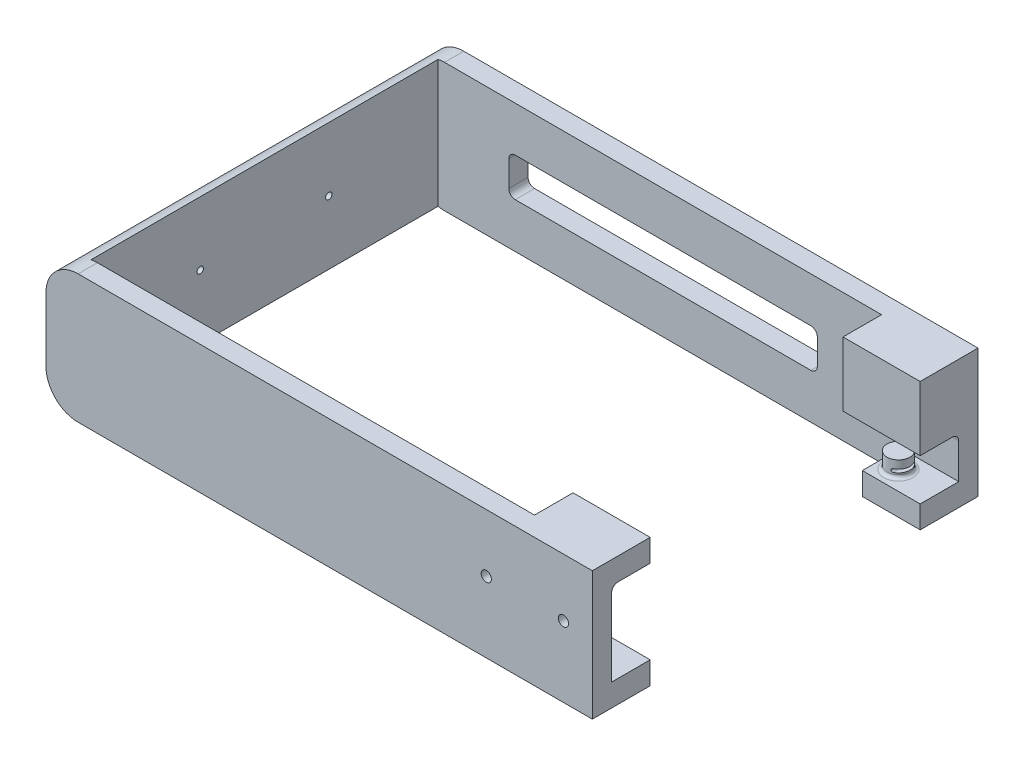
SolidWorks part; units mm, degrees
ref_plane "Front Plane" through (0, 0, 0) normal (0, 0, 1) x (1, 0, 0)
ref_plane "Top Plane" through (0, 0, 0) normal (0, 1, 0) x (1, 0, 0)
ref_plane "Right Plane" through (0, 0, 0) normal (1, 0, 0) x (0, 0, -1)
sketch "Sketch1" plane through (0, 0, 0) normal (0, 0, 1) x (1, 0, 0)
  line L1 (-42.5, 20) -> (42.5, 20)
  line L2 (-42.5, 20) -> (-42.5, 0)
  line L3 (-42.5, 0) -> (42.5, 0)
  line L4 (42.5, 20) -> (42.5, 0)
  dimension "D1" = 20
  dimension "D2" = 85
extrude "Extrude1" add sketch "Sketch1" along normal blind 3
sketch "Sketch2" plane through (0, 0, 0) normal (0, 1, 0) x (1, 0, 0)
  line L0 (33.5, -3) -> (33.5, -9)
  line L1 (42.5, -3) -> (-42.5, -3) construction
  line L2 (42.5, -3) -> (42.5, -9)
  line L3 (33.5, -3) -> (42.5, -3)
  line L4 (42.5, -9) -> (33.5, -9)
  line L5 (42.5, -3) -> (42.5, 0) construction
  dimension "D1" = 6
  dimension "D2" = 9
extrude "Extrude2" add sketch "Sketch2" along normal blind 3.5
sketch "Sketch4" plane through (0, 0, 3) normal (0, 0, 1) x (1, 0, 0)
  line L0 (-42.5, 0) -> (33.5, 0) construction
  line L1 (-42.5, 20) -> (-38.5, 20)
  line L2 (-42.5, 20) -> (-42.5, 0)
  line L3 (-42.5, 0) -> (-38.5, 0)
  line L4 (-38.5, 20) -> (-38.5, 0)
  dimension "D1" = 4
extrude "Extrude3" add sketch "Sketch4" along normal blind 27
mirror "Mirror2" about plane through (-42.5, 0, 30) normal (0, 0, 1) of "Extrude3", "Extrude1"
sketch "Sketch8" plane through (0, 0, 57) normal (0, 0, 1) x (1, 0, 0)
  line L1 (-42.5, 0) -> (42.5, 0)
  line L2 (-42.5, 0) -> (-42.5, 20)
  line L3 (-42.5, 20) -> (42.5, 20)
  line L4 (42.5, 0) -> (42.5, 20)
extrude "Extrude5" add sketch "Sketch8" along normal blind 3
ref_plane "Plane1" through (0, 0, 30) normal (0, 0, 1) x (1, 0, 0)
mirror "Mirror3" about plane through (0, 0, 30) normal (0, 0, 1) of "Extrude2"
fillet "Fillet1" radius 5 7 edges at (-42.5, 20, 30) (-42.5, 0, 30)
sketch "Sketch14" plane through (0, 0, 0) normal (0, 0, -1) x (-1, 0, 0)
  line L0 (-42.5, 10) -> (42.5, 10) construction
  line L1 (-20.5, 13) -> (27.5, 13)
  line L2 (-20.5, 13) -> (-20.5, 7)
  line L3 (-20.5, 7) -> (27.5, 7)
  line L4 (27.5, 13) -> (27.5, 7)
  line L5 (-42.5, 0) -> (-42.5, 20) construction
  line L6 (42.5, 15) -> (42.5, 5) construction
  line L8 (38.5, 0.101) -> (38.5, 19.899) construction
  dimension "D1" = 6
  dimension "D2" = 22
  dimension "D3" = 11
extrude "Cut-Extrude1" cut sketch "Sketch14" against normal up to next
sketch "Sketch16" plane through (0, 20, 0) normal (0, 1, 0) x (-1, 0, 0)
  line L1 (-42.5, 3) -> (-30.5, 3)
  line L2 (-42.5, 3) -> (-42.5, 9)
  line L3 (-42.5, 9) -> (-30.5, 9)
  line L4 (-30.5, 3) -> (-30.5, 9)
  dimension "D1" = 12
  dimension "D2" = 6
extrude "Stop1" add sketch "Sketch16" against normal blind 10
sketch "Sketch19" plane through (0, 20, 0) normal (0, 1, 0) x (-1, 0, 0)
  line L0 (-42.5, 57) -> (37.5, 57) construction
  line L1 (-30.5, 57) -> (-42.5, 57)
  line L2 (-42.5, 57) -> (-42.5, 51)
  line L3 (-42.5, 51) -> (-30.5, 51)
  line L4 (-30.5, 57) -> (-30.5, 51)
  dimension "D1" = 12
  dimension "D2" = 6
extrude "Stop2" add sketch "Sketch19" against normal blind 3.5
ref_plane "Plane2" through (0, 0, 6) normal (0, 0, 1) x (1, 0, 0)
ref_plane "Plane3" through (0, 0, 54) normal (0, 0, 1) x (1, 0, 0)
ref_plane "Plane4" through (0, 10, 0) normal (0, 1, 0) x (-1, 0, 0)
hole_wizard "1/16 (0.0625) Diameter Hole1" positions "Sketch26" profile "Sketch25" hole size "1/16" standard "Ansi Inch"
sketch "Sketch26" plane through (0, 0, 57) normal (0, 0, -1) x (-1, 0, 0)
  line L1 (-42.5, 0) -> (-42.5, 20) construction
  line L3 (-38, 11) -> (-26, 11) construction
  line L4 (-42.5, 10) -> (-20.5, 10) construction
  line L5 (-20.5, 13) -> (-20.5, 7) construction
  point P0 (-26, 11)
  point P1 (-38, 11)
  dimension "D1" = 12
  dimension "D2" = 4.5
  dimension "D3" = 1
sketch "Sketch25" plane through (26, 11, 57) normal (1, 0, 0) x (0, 1, 0)
  line L0 (0, 0) -> (0, 12.4769)
  line L1 (0, 12.4769) -> (0.7937, 12)
  line L2 (0.7937, 12) -> (0.7937, 0)
  line L5 (0.7937, 0) -> (0, 0)
  line L10 (0, 12.4769) -> (-0.7938, 12) construction
  line L11 (0, -6.35) -> (0, 107.95) construction
  dimension "Hole Dia." = 1.5875
  dimension "Hole Depth" = 12
  dimension "Drill Angle" = 118
fillet "Fillet6" radius 1 9 edges at (20.5, 7, 1.5) (20.5, 13, 1.5) (-27.5, 13, 1.5) (-27.5, 7, 1.5) (36.5, 10, 3) (36.5, 16.5, 57) (33.5, 1.75, 57)
ref_plane "mating_plane" through (0, 0, 30) normal (0, 0, 1) x (1, 0, 0)
sketch "Sketch24" plane through (0, 3.5, 0) normal (0, 1, 0) x (-1, 0, 0)
  line L0 (-42.5, 9) -> (-42.5, 0) construction
  line L1 (-30.5, 9) -> (-42.5, 9) construction
  line L2 (-42.5, 51) -> (-30.5, 51) construction
  circle A0 centre (-36.125, 6) radius 1.778
  circle A2 centre (-36.125, 54) radius 1.778
  dimension "D1" = 3.556
  dimension "D2" = 6.375
  dimension "D4" = 3
  dimension "D3" = 3
extrude "Extrude9" add sketch "Sketch24" along normal blind 2.5
sketch "Sketch28" plane through (0, 0, 30) normal (0, 0, 1) x (1, 0, 0)
  line L0 (37.903, 4.75) -> (36.903, 4.75)
  line L1 (36.903, 4.25) -> (37.903, 4.25)
  line L2 (37.903, 4.25) -> (37.903, 4.75)
  line L4 (37.903, 3.5) -> (37.903, 6) construction
  line L8 (42.5, 3.5) -> (32.5, 3.5) construction
  arc A0 (36.903, 4.75) -> (36.903, 4.25) centre (36.903, 4.5) ccw
  dimension "D1" = 0.25
  dimension "D2" = 1
  dimension "D3" = 1
extrude "Cut-Extrude2" cut sketch "Sketch28" against normal up to surface and the other way up to surface
fillet "Fillet7" radius 0.5 2 edges at (36.125, 3.5, 4.222) (36.125, 3.5, 52.222)
sketch "Sketch29" plane through (-42.5, 0, 0) normal (-1, 0, 0) x (0, 0, 1)
  circle A0 centre (40, 10) radius 0.5
  circle A1 centre (20, 10) radius 0.5
  dimension "D1" = 1
extrude "Cut-Extrude3" cut sketch "Sketch29" against normal through all
